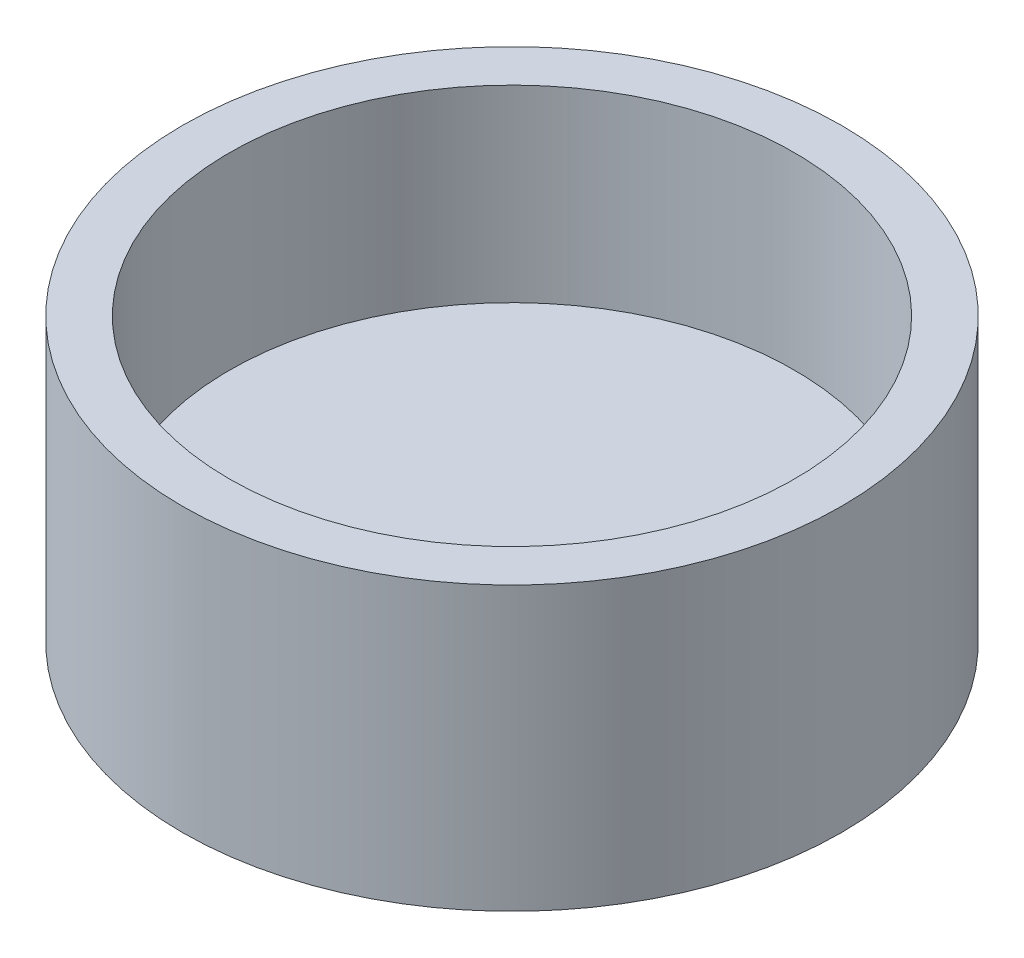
SolidWorks part; units mm, degrees
ref_plane "Front Plane" through (0, 0, 0) normal (0, 0, 1) x (1, 0, 0)
ref_plane "Top Plane" through (0, 0, 0) normal (0, 1, 0) x (1, 0, 0)
ref_plane "Right Plane" through (0, 0, 0) normal (1, 0, 0) x (0, 0, -1)
sketch "Sketch1" plane through (0, 0, 0) normal (0, 1, 0) x (1, 0, 0)
  circle A0 centre (0, 0) radius 44.45
  dimension "D1" = 88.9
extrude "Boss-Extrude1" add sketch "Sketch1" along normal blind 38.1
sketch "Sketch2" plane through (0, 38.1, 0) normal (0, 1, 0) x (1, 0, 0)
  circle A0 centre (0, 0) radius 38.1
  dimension "D1" = 76.2
extrude "Cut-Extrude1" cut sketch "Sketch2" against normal blind 25.4
